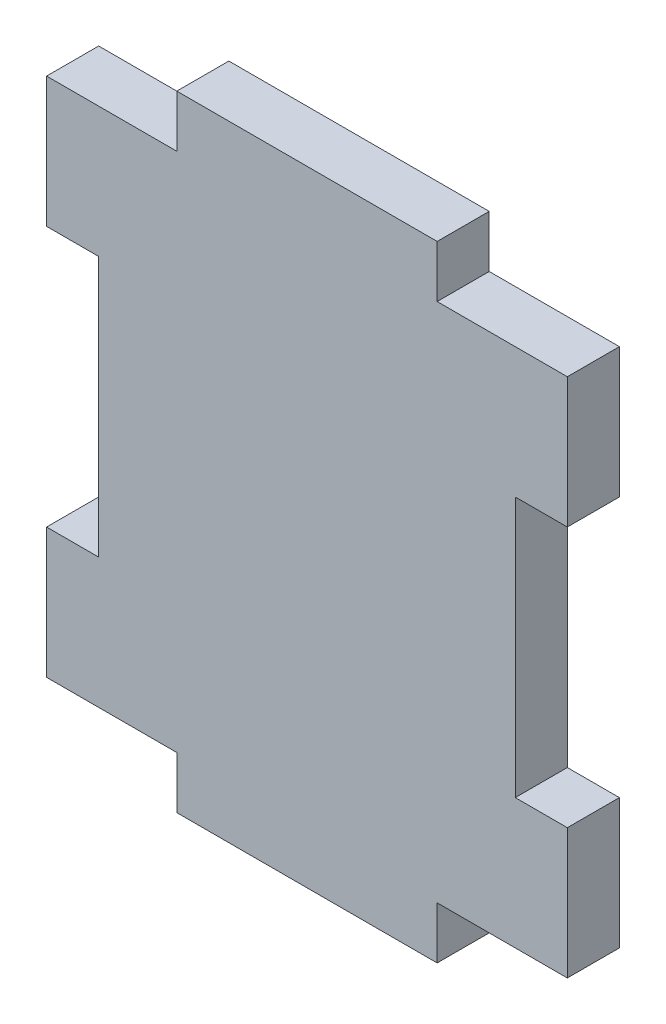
SolidWorks part; units mm, degrees
ref_plane "Alzado" through (0, 0, 0) normal (0, 0, 1) x (1, 0, 0)
ref_plane "Planta" through (0, 0, 0) normal (0, 1, 0) x (1, 0, 0)
ref_plane "Vista lateral" through (0, 0, 0) normal (1, 0, 0) x (0, 0, -1)
sketch "Croquis1" plane through (0, 0, 0) normal (0, 0, 1) x (1, 0, 0)
  line L0 (0, 25.5) -> (0, 33)
  line L2 (0, 3) -> (0, 10.5)
  line L4 (30, 3) -> (30, 10.5)
  line L7 (3, 25.5) -> (3, 10.5)
  line L10 (3, 25.5) -> (0, 25.5)
  line L11 (3, 10.5) -> (0, 10.5)
  line L12 (7.5, 33) -> (7.5, 36)
  line L13 (22.5, 33) -> (22.5, 36)
  line L14 (27, 25.5) -> (30, 25.5)
  line L15 (27, 10.5) -> (30, 10.5)
  line L16 (7.5, 3) -> (7.5, 0)
  line L17 (22.5, 3) -> (22.5, 0)
  line L18 (30, 25.5) -> (30, 33)
  line L19 (27, 25.5) -> (27, 10.5)
  line L20 (7.5, 33) -> (0, 33)
  line L21 (22.5, 33) -> (30, 33)
  line L22 (7.5, 3) -> (0, 3)
  line L23 (22.5, 3) -> (30, 3)
  line L24 (7.5, 36) -> (22.5, 36)
  line L25 (7.5, 0) -> (22.5, 0)
  point P12 (15, 3)
  point P15 (3, 18)
extrude "Saliente-Extruir1" add sketch "Croquis1" along normal blind 3
